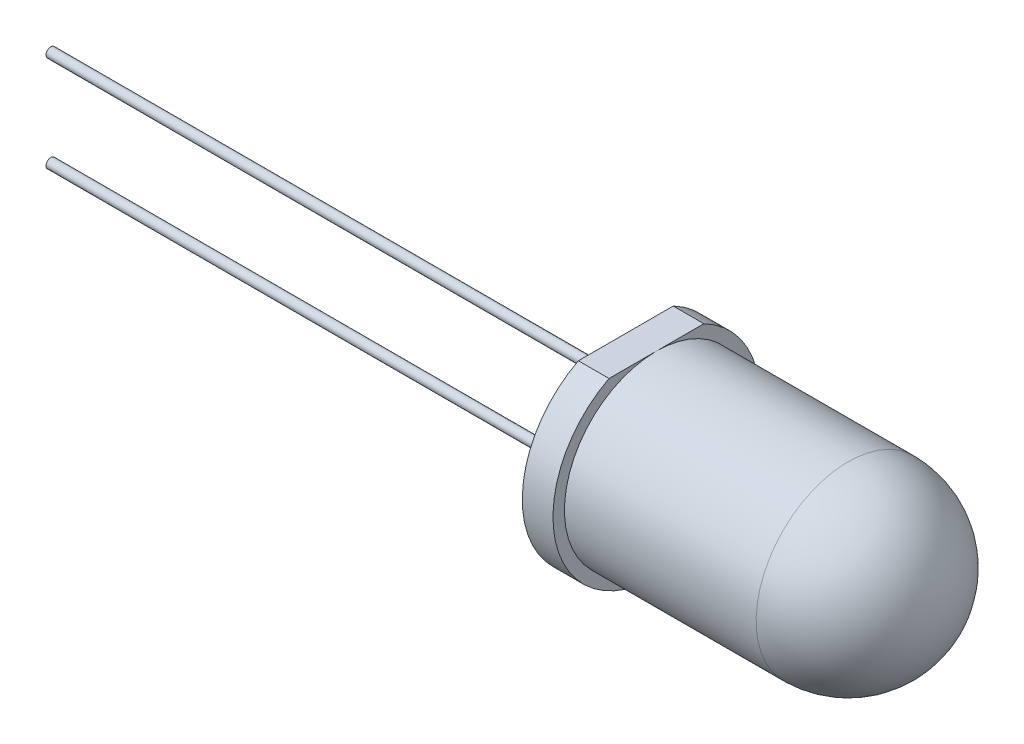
SolidWorks part; units mm, degrees
ref_plane "Plan de face" through (0, 0, 0) normal (0, 0, 1) x (1, 0, 0)
ref_plane "Plan de dessus" through (0, 0, 0) normal (0, 1, 0) x (1, 0, 0)
ref_plane "Plan de droite" through (0, 0, 0) normal (1, 0, 0) x (0, 0, -1)
sketch "Esquisse1" plane through (0, 0, 0) normal (0, 0, 1) x (1, 0, 0)
  line L0 (0, 2.4) -> (0, 2.7)
  line L1 (0, 2.7) -> (-0.8, 2.7)
  line L2 (-0.8, 2.7) -> (-0.8, 0)
  line L3 (-0.8, 0) -> (7.4, 0)
  line L4 (0, 2.4) -> (5, 2.4)
  line L5 (-0.8, 0) -> (-2.4784, 0) construction
  arc A0 (5, 2.4) -> (7.4, 0) centre (5, 0) cw
  dimension "D1" = 0.8
  dimension "D2" = 4.8
  dimension "D3" = 8.2
  dimension "D4" = 5.4
revolve "Révolution1" add sketch "Esquisse1" angle 360 about L5
sketch "Esquisse2" plane through (-0.8, 0, 0) normal (-1, 0, 0) x (0, 0, 1)
  line L0 (-2.7, 0) -> (2.7, 0) construction
  circle A0 centre (0, 1.25) radius 0.125
  circle A1 centre (0, -1.25) radius 0.125
  circle A2 centre (0, 0) radius 2.7 construction
  dimension "D1" = 0.25
  dimension "D2" = 2.5
extrude "Boss.-Extru.1" add sketch "Esquisse2" along normal blind 15
sketch "Esquisse4" plane through (0, 0, 0) normal (1, 0, 0) x (0, 0, -1)
  line L1 (-2.0942, 3.0052) -> (2.1698, 3.0052)
  line L2 (-2.0942, 3.0052) -> (-2.0942, 2.4)
  line L3 (-2.0942, 2.4) -> (2.1698, 2.4)
  line L4 (2.1698, 3.0052) -> (2.1698, 2.4)
  circle A0 centre (0, 0) radius 2.4 construction
extrude "Enlèv. mat.-Extru.1" cut sketch "Esquisse4" against normal through all
